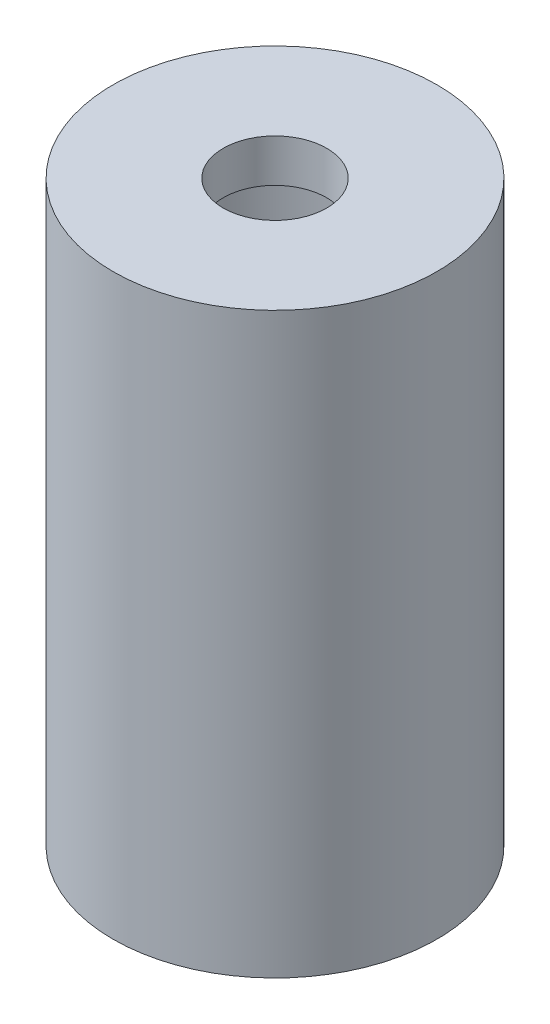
SolidWorks part; units mm, degrees
ref_plane "Front Plane" through (0, 0, 0) normal (0, 0, 1) x (1, 0, 0)
ref_plane "Top Plane" through (0, 0, 0) normal (0, 1, 0) x (1, 0, 0)
ref_plane "Right Plane" through (0, 0, 0) normal (1, 0, 0) x (0, 0, -1)
sketch "Sketch1" plane through (0, 0, 0) normal (0, 1, 0) x (1, 0, 0)
  circle A0 centre (0, 0) radius 27.8
  circle A1 centre (0, 0) radius 37.8
  dimension "D1" = 55.6
  dimension "D2" = 10
extrude "Boss-Extrude1" add sketch "Sketch1" along normal blind 125
sketch "Sketch2" plane through (0, 125, 0) normal (0, 1, 0) x (1, 0, 0)
  circle A0 centre (0, 0) radius 37.8
extrude "Boss-Extrude2" add sketch "Sketch2" along normal blind 10
sketch "Sketch3" plane through (0, 0, 0) normal (0, -1, 0) x (-1, 0, 0)
  circle A0 centre (0, 0) radius 37.8
sketch "Sketch4" plane through (0, 135, 0) normal (0, 1, 0) x (1, 0, 0)
  circle A0 centre (0, 0) radius 12.0896
extrude "Cut-Extrude1" cut sketch "Sketch4" against normal blind 10
